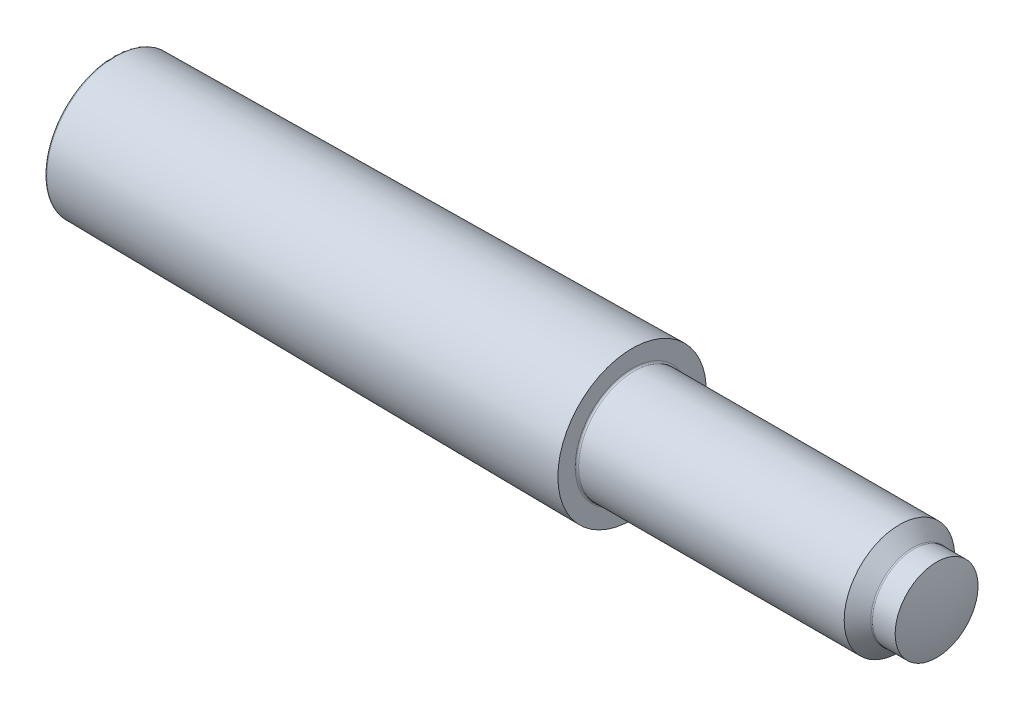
SolidWorks part; units mm, degrees
ref_plane "Front" through (0, 0, 0) normal (0, 0, 1) x (1, 0, 0)
ref_plane "Top" through (0, 0, 0) normal (0, 1, 0) x (1, 0, 0)
ref_plane "Right" through (0, 0, 0) normal (1, 0, 0) x (0, 0, -1)
sketch "BodySke" plane through (0, 0, 0) normal (0, 0, 1) x (1, 0, 0)
  line L0 (-8.7403, 0) -> (75.0119, 0) construction
  line L1 (0, 0) -> (0, 10)
  line L2 (0, 10) -> (75, 10.75)
  line L3 (75, 10.75) -> (75, 8)
  line L4 (75, 8) -> (113.7, 8)
  line L5 (113.7, 8) -> (115.7, 6)
  line L6 (115.7, 6) -> (119.0788, 6)
  line L7 (0, 0) -> (120, 0)
  line L8 (81, 20.1179) -> (81, -6.4248) construction
  line L10 (83, 20.1179) -> (83, -6.4248) construction
  arc A0 (120, 0) -> (119.0788, 6) centre (100, 0) ccw
  dimension "D1" = 45
  dimension "D2" = 0.573
  dimension "Head_rad" = 20
  dimension "Length" = 120
  dimension "Diameter" = 20
  dimension "Thread_dia" = 16
  dimension "Thread_len" = 39
  dimension "Thread_clr" = 6
  dimension "Head_dia" = 12
  dimension "Head_ht" = 4.3
  dimension "Advance" = 2
revolve "Body" add sketch "BodySke" angle 360 about L0
sketch "ThdSchSke" plane through (0, 0, 0) normal (0, 0, 1) x (1, 0, 0)
  line L0 (81, 6.8985) -> (80.1937, 8.05)
  line L1 (81, 0) -> (81, 10.6732) construction
  line L2 (81, 6.8985) -> (81.8063, 8.05)
  line L3 (81.8063, 8.05) -> (80.1937, 8.05)
  line L4 (112.0749, 0) -> (123.8916, 0) construction
  line L8 (75, -10.75) -> (75, 10.75) construction
  dimension "D1" = 70
  dimension "Inset" = 6
  dimension "Thread_minor" = 13.797
  dimension "DieOD" = 16.1
revolve "ThreadSchematic" [suppressed] cut sketch "ThdSchSke" angle 360 about L4
pattern_linear "ThdSchPat" [suppressed]
fillet "Fillets" radius 0.25 3 edges at (0, 0, 10) (75, 0, 8) (115.7, 0, 6)
equation "' \"Diameter@BodySke\" = 20"
equation "' \"Thread_dia@BodySke\" = 16"
equation "' \"Advance@BodySke\" = 2"
equation "' \"Thread_clr@BodySke\" = 6"
equation "' \"Thread_len@BodySke\" = 39"
equation "' \"Head_dia@BodySke\" = 12"
equation "' \"Head_ht@BodySke\" = 4.3"
equation "' \"Length@BodySke\" = 120"
equation "' \"Thread_minor@ThreadCosmetic\"  = 13.797"
equation "' \"Diameter@BodySke\" = 5"
equation "' \"Thread_dia@BodySke\" = 5"
equation "' \"Advance@BodySke\" = 0.8"
equation "' \"Thread_clr@BodySke\" = 2.4"
equation "' \"Thread_len@BodySke\" = 15.6"
equation "' \"Head_dia@BodySke\" = 3.5"
equation "' \"Head_ht@BodySke\" = 1.5"
equation "' \"Length@BodySke\" = 40"
equation "' \"Thread_minor@ThreadCosmetic\"  = 4.11"
equation "\"Head_rad@BodySke\" = \"Diameter@BodySke\""
equation "\"Length@ThreadCosmetic\" = \"Thread_len@BodySke\" - \"Head_ht@BodySke\""
equation "\"Thread_minor@ThdSchSke\" = \"Thread_minor@ThreadCosmetic\" "
equation "\"DieOD@ThdSchSke\" =  \"Thread_dia@BodySke\" + 0.1"
equation "\"Inset@ThdSchSke\" = \"Thread_clr@BodySke\""
equation "\"Num_threads@ThdSchPat\" = int(  ( \"Thread_len@BodySke\" - \"Head_ht@BodySke\" -   (\"Thread_minor@ThdSchSke\" - \"Head_dia@BodySke\" ) / 2 * tan(45 * 0.0174533) ) / \"Advance@BodySke\" + 0.999 )"
equation "\"Advance@ThdSchPat\" = (  \"Thread_len@BodySke\"  - \"Head_ht@BodySke\"  - (\"Thread_minor@ThdSchSke\" - \"Head_dia@BodySke\" ) / 2 * tan(45 * 0.0174533)) /  (\"Num_threads@ThdSchPat\" ) 'relax it"
